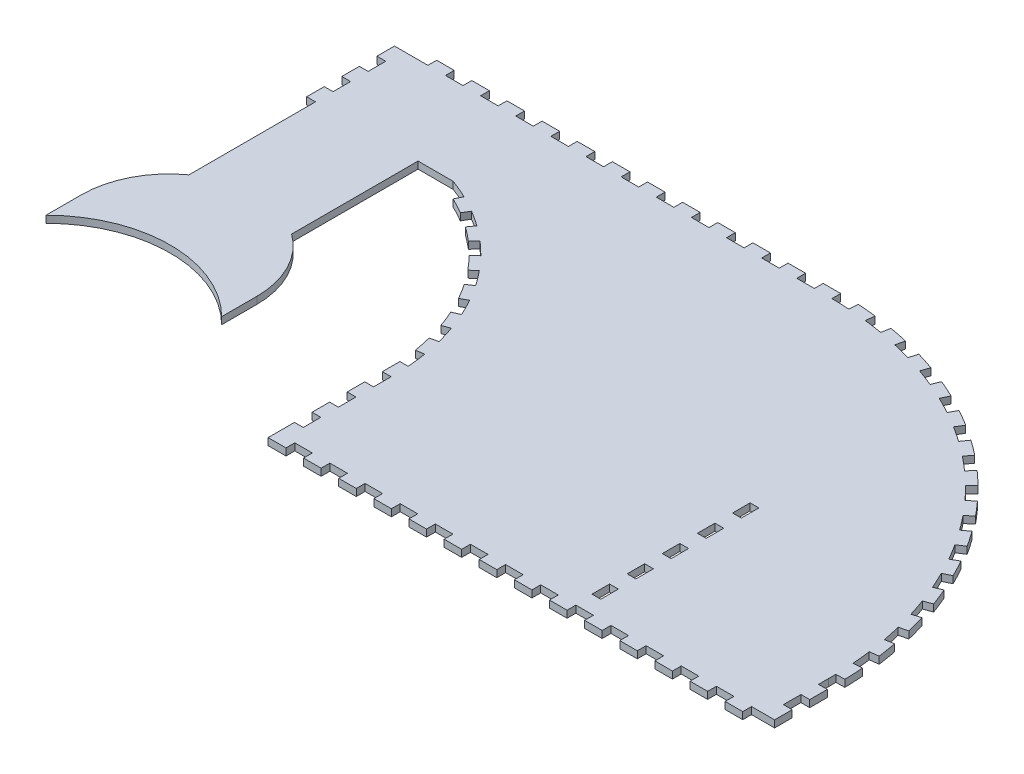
SolidWorks part; units mm, degrees
ref_plane "Front Plane" through (0, 0, 0) normal (0, 0, 1) x (1, 0, 0)
ref_plane "Top Plane" through (0, 0, 0) normal (0, 1, 0) x (1, 0, 0)
ref_plane "Right Plane" through (0, 0, 0) normal (1, 0, 0) x (0, 0, -1)
sketch "Sketch1" plane through (0, 0, 0) normal (0, 1, 0) x (1, 0, 0)
  line L0 (254.7316, -26.8627) -> (254.7316, -49.4898)
  line L1 (18.542, 22.8981) -> (-18.542, 22.8981)
  line L2 (-18.542, 60.9981) -> (-18.542, 92.7481)
  line L3 (18.542, 22.8981) -> (18.542, 60.9981)
  line L4 (-18.542, 22.8981) -> (-18.542, 60.9981)
  line L5 (241.5697, -49.4898) -> (254.7316, -49.4898)
  line L6 (81.1888, -10.5366) -> (81.1888, -49.4898)
  line L7 (18.542, 60.9981) -> (31.242, 60.9981)
  line L8 (-18.542, 92.7481) -> (43.942, 92.7481)
  line L9 (43.942, 92.7481) -> (135.1208, 92.7481)
  line L10 (89.2235, -49.4898) -> (81.1888, -49.4898)
  line L12 (89.2235, -49.4898) -> (241.5697, -49.4898)
  arc A3 (31.242, 60.9981) -> (81.1888, -10.5366) centre (4.9888, -10.5366) cw
  arc A6 (254.7316, -26.8627) -> (135.1208, 92.7481) centre (135.1208, -26.8627) ccw
  dimension "D1" = 76.2
  dimension "D4" = 38.1
  dimension "D5" = 12.7
extrude "main shape" add sketch "Sketch1" along normal blind 2.54
sketch "Sketch17" plane through (0, 2.54, 0) normal (0, 1, 0) x (1, 0, 0)
  line L0 (83.9662, -13.4768) -> (181.1212, -13.4768) construction
  line L1 (83.9662, 6.7162) -> (181.1212, 6.7162)
  line L2 (83.9662, 6.7162) -> (83.9662, -33.6698)
  line L3 (83.9662, -33.6698) -> (181.1212, -33.6698)
  line L4 (181.1212, 6.7162) -> (181.1212, -33.6698)
  line L5 (83.9662, -13.4768) -> (83.9662, 14.3362) construction
  line L6 (83.9662, 14.3362) -> (85.7442, 14.3362) construction
  line L7 (83.9662, -13.4768) -> (83.9662, -41.2898) construction
  line L8 (83.9662, -41.2898) -> (85.7442, -41.2898) construction
  line L9 (181.1212, -13.4768) -> (181.1212, 14.3362) construction
  line L10 (181.1212, 14.3362) -> (179.3432, 14.3362) construction
  line L11 (181.1212, -13.4768) -> (181.1212, -41.2898) construction
  line L12 (181.1212, -41.2898) -> (179.3432, -41.2898) construction
  line L13 (216.1466, 17.1852) -> (216.1466, -39.9648) construction
  line L14 (193.1596, 17.1852) -> (239.1336, 17.1852)
  line L15 (193.1596, 17.1852) -> (193.1596, -39.9648)
  line L16 (193.1596, -39.9648) -> (239.1336, -39.9648)
  line L17 (239.1336, 17.1852) -> (239.1336, -39.9648)
  line L18 (193.1596, -11.3898) -> (239.1336, -11.3898) construction
  line L19 (239.1336, -11.3898) -> (239.1336, 18.2012) construction
  line L21 (239.1336, -11.3898) -> (239.1336, -40.9808) construction
  line L23 (193.1596, -11.3898) -> (193.1596, 18.2012) construction
  line L25 (193.1596, -11.3898) -> (193.1596, -40.9808) construction
  line L27 (181.1212, 6.7162) -> (193.1596, 6.7162) construction
  line L28 (187.1404, 6.7162) -> (187.1404, -49.4898) construction
  line L29 (81.1888, -49.4898) -> (254.7316, -49.4898) construction
  line L30 (185.5529, -43.1398) -> (185.5529, -36.7898)
  line L31 (185.5529, -43.1398) -> (188.7279, -43.1398)
  line L32 (185.5529, -36.7898) -> (188.7279, -36.7898)
  line L33 (188.7279, -43.1398) -> (188.7279, -36.7898)
  line L34 (185.5529, -43.1398) -> (188.7279, -36.7898) construction
  line L35 (185.5529, -36.7898) -> (188.7279, -43.1398) construction
  line L36 (185.5529, -24.0898) -> (188.7279, -24.0898)
  line L37 (188.7279, -30.4398) -> (188.7279, -24.0898)
  line L38 (185.5529, -30.4398) -> (188.7279, -30.4398)
  line L39 (185.5529, -30.4398) -> (185.5529, -24.0898)
  line L40 (187.1404, 19.4162) -> (187.1404, -36.7898) construction
  line L41 (185.5529, -11.3898) -> (188.7279, -11.3898)
  line L42 (188.7279, -17.7398) -> (188.7279, -11.3898)
  line L43 (185.5529, -17.7398) -> (188.7279, -17.7398)
  line L44 (185.5529, -17.7398) -> (185.5529, -11.3898)
  line L45 (187.1404, 32.1162) -> (187.1404, -24.0898) construction
  line L46 (185.5529, 1.3102) -> (188.7279, 1.3102)
  line L47 (188.7279, -5.0398) -> (188.7279, 1.3102)
  line L48 (185.5529, -5.0398) -> (188.7279, -5.0398)
  line L49 (185.5529, -5.0398) -> (185.5529, 1.3102)
  line L50 (187.1404, 44.8162) -> (187.1404, -11.3898) construction
  line L51 (185.5529, 14.0102) -> (188.7279, 14.0102)
  line L52 (188.7279, 7.6602) -> (188.7279, 14.0102)
  line L53 (185.5529, 7.6602) -> (188.7279, 7.6602)
  line L54 (185.5529, 7.6602) -> (185.5529, 14.0102)
  line L55 (187.1404, 57.5162) -> (187.1404, 1.3102) construction
  line L56 (196.3346, -39.9648) -> (196.3346, 17.1852) construction
  line L57 (193.1596, 14.0102) -> (239.1336, 14.0102) construction
  line L58 (235.9586, 17.1852) -> (235.9586, -39.9648) construction
  line L59 (193.1596, -36.7898) -> (239.1336, -36.7898) construction
  circle A0 centre (85.7442, 14.3362) radius 1.778
  circle A1 centre (179.3432, 14.3362) radius 1.778
  circle A2 centre (179.3432, -41.2898) radius 1.778
  circle A3 centre (85.7442, -41.2898) radius 1.778
  circle A4 centre (193.1596, 18.2012) radius 1.27
  arc A5 (193.1596, -36.7898) -> (196.3346, -39.9648) centre (196.3346, -36.7898) ccw
  arc A6 (193.1596, 14.0102) -> (196.3346, 17.1852) centre (196.3346, 14.0102) cw
  arc A7 (239.1336, 14.0102) -> (235.9586, 17.1852) centre (235.9586, 14.0102) ccw
  arc A8 (235.9586, -39.9648) -> (239.1336, -36.7898) centre (235.9586, -36.7898) ccw
  circle A9 centre (239.1336, 18.2012) radius 1.27
  circle A10 centre (239.1336, -40.9808) radius 1.27
  circle A11 centre (193.1596, -40.9808) radius 1.27
  circle A12 centre (216.1466, 37.0059) radius 6.35
  point P44 (187.1404, -39.9648)
  dimension "D1" = 97.155
  dimension "D2" = 40.386
  dimension "D3" = 27.813
  dimension "D4" = 1.778
  dimension "D5" = 27.813
  dimension "D6" = 1.778
  dimension "D7" = 27.813
  dimension "D8" = 27.813
  dimension "D9" = 1.778
  dimension "D10" = 1.778
  dimension "D11" = 45.974
  dimension "D12" = 57.15
  dimension "D13" = 29.591
  dimension "D15" = 29.591
  dimension "D16" = 29.591
  dimension "D17" = 29.591
  dimension "D21" = 3.175
  dimension "D22" = 1.5875
  dimension "D23" = 6.35
  dimension "D24" = 6.35
  dimension "D26" = 3.175
  dimension "D27" = 3.175
  dimension "D28" = 3.175
  dimension "D29" = 3.175
  dimension "D25" = 5
extrude "display and controls" cut sketch "Sketch17" against normal blind 3.175 contours L54 L53 L52 L51 | L49 L48 L47 L46 | L44 L43 L42 L41 | L39 L38 L37 L36 | L31 L33 L32 L30
sketch "Sketch19" plane through (0, 2.54, 0) normal (0, 1, 0) x (1, 0, 0)
  line L1 (-18.542, 92.7481) -> (-21.717, 92.7481)
  line L2 (-18.542, 92.7481) -> (-18.542, 86.3981)
  line L3 (-18.542, 86.3981) -> (-21.717, 86.3981)
  line L4 (-21.717, 92.7481) -> (-21.717, 86.3981)
  dimension "D1" = 3.175
  dimension "D2" = 6.35
extrude "teeth near back" add sketch "Sketch19" against normal up to surface (2.54 mm away)
pattern_linear "LPattern1" count 3 spacing 12.7 along (0, 0, 1) of "teeth near back"
sketch "Sketch20" plane through (0, 2.54, 0) normal (0, 1, 0) x (1, 0, 0)
  line L1 (254.7316, -49.4898) -> (257.9066, -49.4898)
  line L2 (254.7316, -49.4898) -> (254.7316, -43.1398)
  line L3 (254.7316, -43.1398) -> (257.9066, -43.1398)
  line L4 (257.9066, -49.4898) -> (257.9066, -43.1398)
  dimension "D1" = 3.175
  dimension "D2" = 6.35
extrude "teeth short exterior" add sketch "Sketch20" against normal up to surface (2.54 mm away)
pattern_linear "LPattern2" count 2 spacing 12.7 along (0, 0, -1) of "teeth short exterior"
sketch "Sketch21" plane through (0, 2.54, 0) normal (0, 1, 0) x (1, 0, 0)
  line L0 (257.9066, -30.4398) -> (257.9066, -24.0898)
  line L1 (257.9066, -24.0898) -> (135.1208, -26.8627)
  line L2 (257.5687, -17.3469) -> (135.1208, -26.8627)
  line L3 (256.8608, -10.6327) -> (135.1208, -26.8627)
  line L4 (255.785, -3.9676) -> (135.1208, -26.8627)
  line L5 (254.3446, 2.6283) -> (135.1208, -26.8627)
  line L6 (252.5439, 9.1351) -> (135.1208, -26.8627)
  line L7 (250.3884, 15.5332) -> (135.1208, -26.8627)
  line L8 (247.8846, 21.8031) -> (135.1208, -26.8627)
  line L9 (245.04, 27.926) -> (135.1208, -26.8627)
  line L10 (241.8633, 33.8833) -> (135.1208, -26.8627)
  line L11 (238.364, 39.657) -> (135.1208, -26.8627)
  line L12 (234.5528, 45.2297) -> (135.1208, -26.8627)
  line L13 (230.441, 50.5846) -> (135.1208, -26.8627)
  line L14 (226.0413, 55.7055) -> (135.1208, -26.8627)
  line L15 (221.3668, 60.5768) -> (135.1208, -26.8627)
  line L16 (216.4316, 65.1839) -> (135.1208, -26.8627)
  line L17 (211.2508, 69.5129) -> (135.1208, -26.8627)
  line L18 (205.8399, 73.5506) -> (135.1208, -26.8627)
  line L19 (200.2154, 77.2849) -> (135.1208, -26.8627)
  line L20 (194.3941, 80.7045) -> (135.1208, -26.8627)
  line L21 (188.3937, 83.7991) -> (135.1208, -26.8627)
  line L22 (182.2323, 86.5593) -> (135.1208, -26.8627)
  line L23 (175.9286, 88.9767) -> (135.1208, -26.8627)
  line L24 (169.5015, 91.044) -> (135.1208, -26.8627)
  line L25 (162.9706, 92.7551) -> (135.1208, -26.8627)
  line L26 (156.3555, 94.1047) -> (135.1208, -26.8627)
  line L27 (149.6762, 95.0888) -> (135.1208, -26.8627)
  line L28 (142.953, 95.7044) -> (135.1208, -26.8627)
  line L29 (136.206, 95.9496) -> (135.1208, -26.8627)
  arc A0 (257.9066, -24.0898) -> (136.206, 95.9496) centre (135.1208, -26.8627) ccw
  arc A1 (252.5439, -24.2109) -> (136.1586, 90.5858) centre (135.1208, -26.8627) ccw
  point P37 (135.1208, -26.8627)
  dimension "D1" = 29
extrude "teeth exterior curve" add sketch "Sketch21" against normal up to surface (2.54 mm away) contours A1 L1 A0 L2 | A1 L3 A0 L4 | A1 L5 A0 L6 | A1 L7 A0 L8 | A1 L9 A0 L10 | A1 L11 A0 L12 | A1 L13 A0 L14 | A1 L15 A0 L16 | A1 L17 A0 L18 | A1 L19 A0 L20 | A1 L21 A0 L22 | A1 L23 A0 L24 | A1 L25 A0 L26 | A1 L27 A0 L28
sketch "Sketch22" plane through (0, 2.54, 0) normal (0, 1, 0) x (1, 0, 0)
  line L0 (142.7485, 92.5046) -> (136.3985, 92.5046)
  line L1 (136.3985, 92.5046) -> (136.3985, 95.9231)
  line L2 (136.3985, 95.9231) -> (130.0485, 95.9231)
  line L3 (130.0485, 95.9231) -> (130.0485, 92.7481)
  line L4 (-21.717, 92.7481) -> (135.1208, 92.7481) construction
  line L5 (136.3985, 92.5046) -> (130.0485, 92.7481)
  dimension "D1" = 3.175
  dimension "D2" = 6.35
  dimension "D3" = 6.35
extrude "teeth across back" add sketch "Sketch22" against normal up to surface (2.54 mm away) contours L1 L2 L3 L5
pattern_linear "LPattern3" count 12 spacing 12.7 along (-1, 0, 0) of "teeth across back"
sketch "Sketch23" plane through (0, 2.54, 0) normal (0, 1, 0) x (1, 0, 0)
  line L1 (81.1888, -49.4898) -> (78.0138, -49.4898)
  line L2 (81.1888, -49.4898) -> (81.1888, -43.1398)
  line L3 (81.1888, -43.1398) -> (78.0138, -43.1398)
  line L4 (78.0138, -49.4898) -> (78.0138, -43.1398)
  dimension "D1" = 3.175
  dimension "D2" = 6.35
extrude "teeth short interior" add sketch "Sketch23" against normal up to surface (2.54 mm away)
pattern_linear "LPattern4" count 4 spacing 12.7 along (0, 0, -1) of "teeth short interior"
sketch "Sketch24" plane through (0, 2.54, 0) normal (0, 1, 0) x (1, 0, 0)
  line L0 (4.9888, -10.5366) -> (80.2522, 1.7946)
  line L1 (4.9888, -10.5366) -> (78.891, 8.3073)
  line L2 (78.0138, -5.0398) -> (81.4715, -5.0398)
  line L3 (81.4715, -5.0398) -> (80.9739, -4.817)
  line L4 (4.9888, -10.5366) -> (80.9739, -4.817)
  line L5 (80.9739, -4.817) -> (81.0383, -4.7824)
  line L6 (4.9888, -10.5366) -> (76.9674, 14.6766)
  line L7 (4.9888, -10.5366) -> (74.4961, 20.854)
  line L8 (4.9888, -10.5366) -> (71.4957, 26.7925)
  line L9 (4.9888, -10.5366) -> (67.9892, 32.4469)
  line L10 (4.9888, -10.5366) -> (64.0032, 37.7742)
  line L11 (4.9888, -10.5366) -> (59.568, 42.7338)
  line L12 (4.9888, -10.5366) -> (54.7175, 47.288)
  line L13 (4.9888, -10.5366) -> (49.4886, 51.4021)
  line L14 (4.9888, -10.5366) -> (43.9209, 55.0448)
  line L15 (4.9888, -10.5366) -> (38.057, 58.1884)
  arc A0 (80.9903, -5.0398) -> (31.242, 60.9981) centre (4.9888, -10.5366) ccw construction
  arc A1 (78.0138, -5.0398) -> (36.7409, 55.4533) centre (4.9888, -10.5366) ccw
  arc A2 (81.0383, -4.7824) -> (32.3037, 60.671) centre (4.9888, -10.5366) ccw
  point P25 (4.9888, -10.5366)
  dimension "D2" = 60
  dimension "D1" = 13
extrude "teeth interior curve" add sketch "Sketch24" against normal up to surface (2.54 mm away) contours L0 A2 L1 A1 | L6 A2 L7 A1 | L8 A2 L9 A1 | L10 A2 L11 A1 | L12 A2 L13 A1 | L14 A2 L15 A1
sketch "Sketch25" plane through (0, 2.54, 0) normal (0, 1, 0) x (1, 0, 0)
  line L1 (78.0138, -49.4898) -> (84.4654, -49.4898)
  line L2 (78.0138, -49.4898) -> (78.0138, -52.6648)
  line L3 (78.0138, -52.6648) -> (84.4654, -52.6648)
  line L4 (84.4654, -49.4898) -> (84.4654, -52.6648)
  dimension "D1" = 3.175
  dimension "D2" = 6.4516
extrude "teeth corner snaggletooth" add sketch "Sketch25" against normal up to surface (2.54 mm away)
sketch "Sketch26" plane through (0, 2.54, 0) normal (0, 1, 0) x (1, 0, 0)
  line L0 (257.9066, -49.4898) -> (84.4654, -49.4898) construction
  line L1 (90.8154, -49.4898) -> (97.1654, -49.4898)
  line L2 (90.8154, -49.4898) -> (90.8154, -52.6648)
  line L3 (90.8154, -52.6648) -> (97.1654, -52.6648)
  line L4 (97.1654, -49.4898) -> (97.1654, -52.6648)
  line L5 (84.4654, -52.6648) -> (84.4654, -49.4898) construction
  dimension "D1" = 3.175
  dimension "D2" = 6.35
  dimension "D3" = 6.35
extrude "teeth across front" add sketch "Sketch26" against normal up to surface (2.54 mm away)
pattern_linear "LPattern5" count 13 spacing 12.7 along (1, 0, 0) of "teeth across front"
sketch "Sketch27" plane through (0, 2.54, 0) normal (0, 1, 0) x (1, 0, 0)
  line L0 (18.542, 60.9981) -> (18.542, 15.2781)
  line L1 (18.542, 15.2781) -> (-18.542, 15.2781)
  line L2 (-18.542, 15.2781) -> (-18.542, 60.9981)
  line L3 (-18.542, 60.9981) -> (18.542, 60.9981)
  line L4 (0, 60.9981) -> (0, -16.9651) construction
  line L5 (-31.75, -10.4951) -> (-31.75, -23.1951)
  line L6 (31.75, -10.4951) -> (31.75, -23.1951)
  arc A0 (-31.75, -10.4951) -> (31.75, -10.4951) centre (0, -10.4951) cw
  arc A1 (-31.75, -23.1951) -> (31.75, -23.1951) centre (0, -54.9451) cw
  dimension "D2" = 12.7
  dimension "D4" = 31.75
  dimension "D1" = 45.72
  dimension "D3" = 12.7
extrude "Boss-Extrude1" add sketch "Sketch27" against normal up to surface (2.54 mm away) contours L4 L3 L2 A0 | L3 L4 A0 L0 | A0 L4 L1 | L4 A0 L1 | L4 L1 A0 L5 A1 | L1 L4 A1 L6 A0
